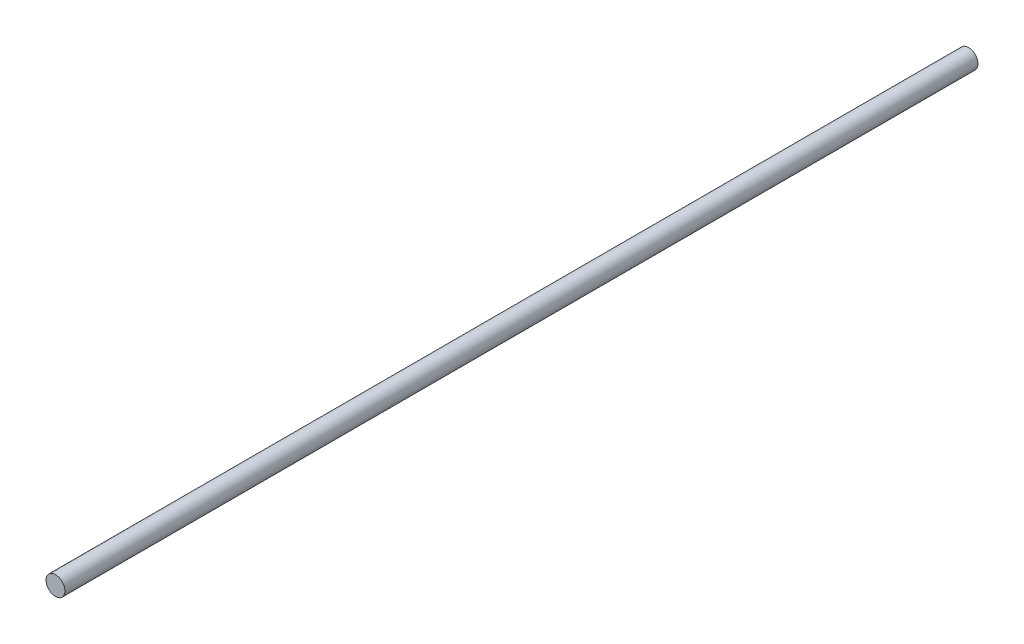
SolidWorks part; units mm, degrees
ref_plane "Спереди" through (0, 0, 0) normal (0, 0, 1) x (1, 0, 0)
ref_plane "Сверху" through (0, 0, 0) normal (0, 1, 0) x (1, 0, 0)
ref_plane "Справа" through (0, 0, 0) normal (1, 0, 0) x (0, 0, -1)
sketch "Эскиз1" plane through (0, 0, 0) normal (0, 0, 1) x (1, 0, 0)
  circle A0 centre (0, 0) radius 4
  dimension "D1" = 8
extrude "Бобышка-Вытянуть1" add sketch "Эскиз1" along normal blind 385
